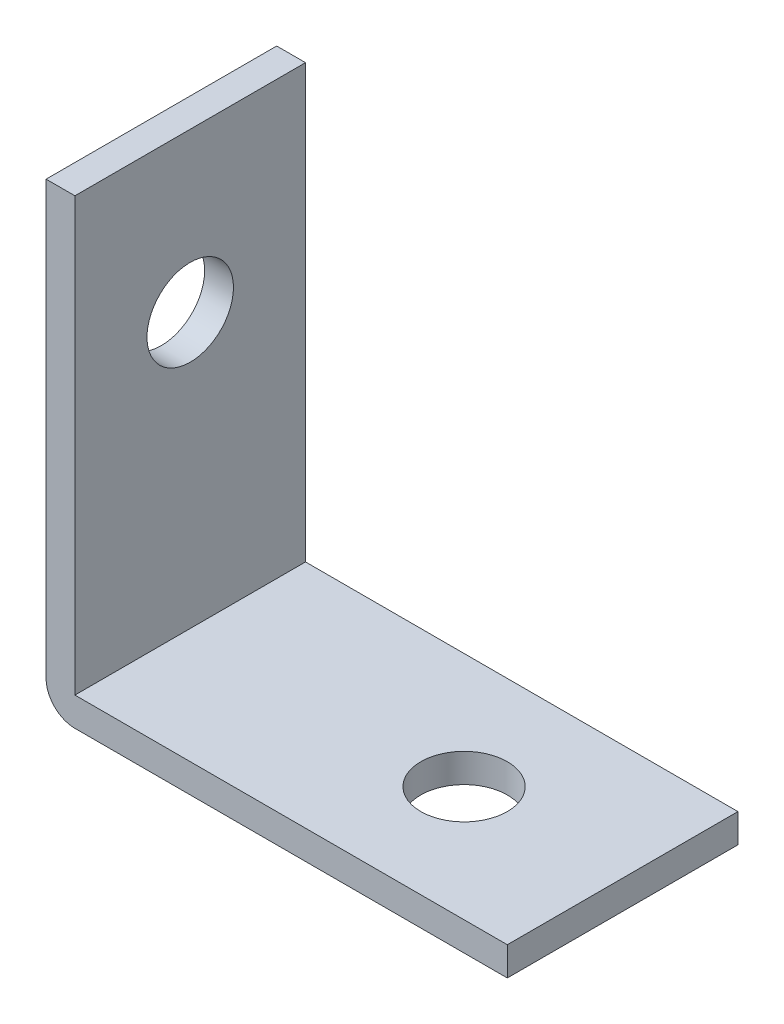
SolidWorks part; units mm, degrees
ref_plane "Front Plane" through (0, 0, 0) normal (0, 0, 1) x (1, 0, 0)
ref_plane "Top Plane" through (0, 0, 0) normal (0, 1, 0) x (1, 0, 0)
ref_plane "Right Plane" through (0, 0, 0) normal (1, 0, 0) x (0, 0, -1)
sketch "Sketch1" plane through (0, 0, 0) normal (0, 1, 0) x (1, 0, 0)
  line L0 (0, 6.35) -> (0, -6.35)
  line L1 (0, 6.35) -> (25.4, 6.35)
  line L2 (0, -6.35) -> (25.4, -6.35)
  line L3 (25.4, 6.35) -> (25.4, -6.35)
  circle A0 centre (16.6687, 0) radius 2.3813
  dimension "D2" = 4.7625
  dimension "D1" = 25.4
  dimension "D3" = 16.6687
  dimension "D4" = 6.35
  dimension "D5" = 6.35
extrude "Boss-Extrude1" add sketch "Sketch1" against normal blind 1.5875
sketch "Sketch2" plane through (0, 0, 0) normal (0, 1, 0) x (1, 0, 0)
  line L0 (0, -6.35) -> (25.4, -6.35) construction
  line L1 (0, 6.35) -> (1.5875, 6.35)
  line L2 (0, 6.35) -> (0, -6.35)
  line L3 (0, -6.35) -> (1.5875, -6.35)
  line L4 (1.5875, 6.35) -> (1.5875, -6.35)
  dimension "D1" = 1.5875
extrude "Boss-Extrude2" add sketch "Sketch2" along normal blind 23.8125
sketch "Sketch3" plane through (1.5875, 0, 0) normal (1, 0, 0) x (0, 0, -1)
  line L0 (-6.35, -1.5875) -> (6.35, -1.5875) construction
  circle A0 centre (0, 15.0813) radius 2.3813
  dimension "D2" = 4.7625
  dimension "D1" = 16.6687
extrude "Cut-Extrude1" cut sketch "Sketch3" against normal through all
fillet "Fillet1" radius 1.5875 1 edges at (0, -1.5875, 0)
